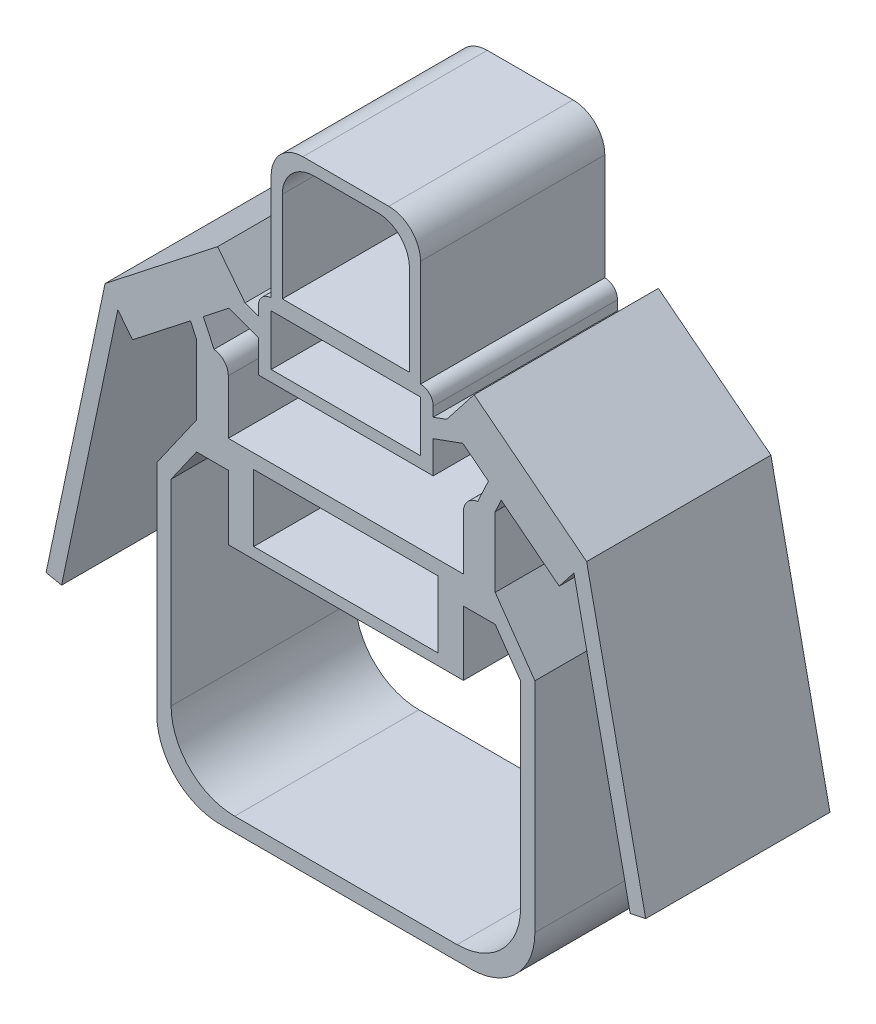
SolidWorks part; units mm, degrees
other "标注1"
sketch "草图17" plane through (-9.7594, -10.85, 5.8) normal (0, 0, 1) x (1, 0, 0)
ref_plane "前视基准面" through (0, 0, 0) normal (0, 0, 1) x (1, 0, 0)
ref_plane "上视基准面" through (0, 0, 0) normal (0, 1, 0) x (1, 0, 0)
ref_plane "右视基准面" through (0, 0, 0) normal (1, 0, 0) x (0, 0, -1)
other "Configuration Table"
sketch "草图1" plane through (0, 0, 0) normal (0, 0, 1) x (1, 0, 0)
  line L0 (2.75, 5.2) -> (3.1729, 5.3539)
  line L1 (-3.7, -1.4) -> (3.7, -1.4)
  line L2 (-3.7, -1.4) -> (-3.7, 1.4)
  line L4 (3.7, -1.4) -> (3.7, 0.1)
  line L5 (-3.7, -1.4) -> (3.7, 1.4) construction
  line L6 (-3.7, 1.4) -> (3.7, -1.4) construction
  line L7 (-2.75, 5.2) -> (2.75, 5.2)
  line L8 (-2.75, 5.2) -> (-2.75, 3.6)
  line L9 (-2.75, 3.6) -> (2.75, 3.6)
  line L10 (2.75, 4.6147) -> (2.75, 3.6)
  line L11 (-2.75, 5.2) -> (2.75, 3.6) construction
  line L12 (-2.75, 3.6) -> (2.75, 5.2) construction
  line L14 (3.7, 0.1) -> (4.7, 0.1)
  line L17 (4.0365, 6.4558) -> (3.1729, 5.3539)
  line L19 (4.0365, 6.4558) -> (7.5782, 3.6797)
  line L33 (2.75, 5.2) -> (2.75, 4.6147) construction
  line L34 (3.1729, 5.3539) -> (3.6828, 4.9542) construction
  line L37 (4.7, 3.6) -> (4.7, 0.1)
  line L38 (-3.7, 1.4) -> (3.7, 1.4)
  line L39 (3.7, 1.4) -> (3.7, 0.1) construction
  line L40 (0, 9.062) -> (0, -4.0269) construction
  line L41 (2.75, 4.6147) -> (3.6828, 4.9542)
  line L48 (3.6828, 4.9542) -> (4.4862, 4.3245)
  line L51 (4.1483, 3.6) -> (4.4862, 4.3245)
  line L53 (4.8902, 4.0078) -> (6.7145, 2.5779)
  line L55 (4.4862, 4.3245) -> (4.8902, 4.0078) construction
  line L56 (4.1483, 3.6) -> (4.7, 3.6) construction
  line L57 (3.7, 1.4) -> (3.7, 3.6)
  line L58 (3.7, 3.6) -> (4.1483, 3.6)
  line L59 (4.7, 3.6) -> (4.8902, 4.0078)
  line L60 (6.7145, 2.5779) -> (7.5782, 3.6797)
  point P0 (0, 0)
  point P6 (0, 4.4)
  dimension "D1" = 7.4
  dimension "D2" = 2.8
  dimension "D3" = 5.5
  dimension "D4" = 1.6
  dimension "D5" = 1
  dimension "D6" = 0.45
  dimension "D7" = 0.45
  dimension "D8" = 110
  dimension "D9" = 3.5
  dimension "D10" = 1.4
  dimension "D11" = 0.5
  dimension "D12" = 2.2
  dimension "D13" = 65
  dimension "D14" = 2.2
  dimension "D15" = 4.5
  dimension "D16" = 0.55
extrude "凸台-拉伸1" add sketch "草图1" along normal blind 5.8
mirror "镜向1" about plane through (0, 0, 0) normal (1, 0, 0) of "凸台-拉伸1"
sketch "草图10" plane through (0, 0, 5.8) normal (0, 0, 1) x (1, 0, 0)
  line L0 (-2.75, 3.6) -> (2.75, 3.6) construction
  line L1 (-2.9, -1.05) -> (2.9, -1.05)
  line L2 (-2.9, -1.05) -> (-2.9, 1.05)
  line L3 (-2.9, 1.05) -> (2.9, 1.05)
  line L4 (2.9, -1.05) -> (2.9, 1.05)
  line L5 (-2.9, -1.05) -> (2.9, 1.05) construction
  line L6 (-2.9, 1.05) -> (2.9, -1.05) construction
  line L7 (-2.35, 5.55) -> (2.35, 5.55)
  line L8 (-2.35, 5.55) -> (-2.35, 3.95)
  line L9 (-2.35, 3.95) -> (2.35, 3.95)
  line L10 (2.35, 5.55) -> (2.35, 3.95)
  point P0 (0, 0)
  point P10 (0, 5.55)
  dimension "D1" = 5.8
  dimension "D2" = 2.1
  dimension "D3" = 4.7
  dimension "D4" = 1.6
  dimension "D5" = 0.35
extrude "切除-拉伸3" cut sketch "草图10" against normal through all
sketch "草图11" plane through (0, 0, 5.8) normal (0, 0, 1) x (1, 0, 0)
  line L0 (-2.35, 5.2) -> (-2.75, 5.2)
  line L1 (-2.75, 5.2) -> (-2.75, 5.9)
  line L2 (-2.75, 5.9) -> (2.75, 5.9)
  line L3 (2.75, 5.9) -> (2.75, 5.2)
  line L4 (2.75, 3.6) -> (2.75, 4.6147) construction
  line L5 (2.75, 5.2) -> (2.35, 5.2)
  line L6 (2.35, 5.2) -> (2.35, 5.55)
  line L7 (2.35, 5.55) -> (-2.35, 5.55)
  line L8 (-2.35, 5.55) -> (-2.35, 5.2)
  line L9 (-2.35, 3.95) -> (2.35, 3.95) construction
  dimension "D1" = 0.35
  dimension "D2" = 1.6
extrude "凸台-拉伸2" add sketch "草图11" against normal up to surface (5.8 mm away)
fillet "圆角1" radius 0.4 2 edges at (-2.75, 5.9, 2.9) (2.75, 5.9, 2.9)
sketch "草图12" plane through (0, 0, 5.8) normal (0, 0, 1) x (1, 0, 0)
  line L0 (7.5782, 3.6797) -> (7.1772, 3.1681)
  line L1 (6.7145, 2.5779) -> (7.5782, 3.6797) construction
  line L2 (7.1772, 3.1681) -> (8.9484, -5.2293)
  line L3 (8.9484, -5.2293) -> (9.4356, -5.1265)
  line L4 (9.4356, -5.1265) -> (7.5782, 3.6797)
  line L5 (-7.5782, 3.6797) -> (-9.4356, -5.1265)
  line L6 (-9.4356, -5.1265) -> (-8.9484, -5.2293)
  line L7 (-8.9484, -5.2293) -> (-7.1772, 3.1681)
  line L8 (-6.7145, 2.5779) -> (-7.5782, 3.6797) construction
  line L9 (-7.1772, 3.1681) -> (-7.5782, 3.6797)
  dimension "D1" = 0.65
  dimension "D2" = 0.65
  dimension "D3" = 50
  dimension "D4" = 50
  dimension "D5" = 9
  dimension "D6" = 9
extrude "凸台-拉伸4" add sketch "草图12" against normal up to surface (5.8 mm away)
sketch "草图13" plane through (0, 0, 5.8) normal (0, 0, 1) x (1, 0, 0)
  line L0 (2.9, -1.05) -> (2.9, 1.05) construction
  line L1 (-2.9, 1.05) -> (2.9, 1.05)
  line L2 (-2.9, 1.05) -> (-2.9, 0.95)
  line L3 (-2.9, 0.95) -> (2.9, 0.95)
  line L4 (2.9, 1.05) -> (2.9, 0.95)
  line L5 (3.7, -1.4) -> (3.7, 0.1) construction
  line L6 (-3.7, -1.4) -> (3.7, -1.4)
  line L7 (-3.7, -1.4) -> (-3.7, -1.5)
  line L8 (-3.7, -1.5) -> (3.7, -1.5)
  line L9 (3.7, -1.4) -> (3.7, -1.5)
  dimension "D1" = 0.1
  dimension "D2" = 0.1
extrude "凸台-拉伸5" add sketch "草图13" against normal up to surface (5.8 mm away)
sketch "草图14" plane through (0, 0, 5.8) normal (0, 0, 1) x (1, 0, 0)
  line L0 (2.9, -1.05) -> (2.9, 0.95) construction
  line L1 (-2.9, -1.05) -> (2.9, -1.05)
  line L2 (-2.9, -1.05) -> (-2.9, -1.15)
  line L3 (-2.9, -1.15) -> (2.9, -1.15)
  line L4 (2.9, -1.05) -> (2.9, -1.15)
  dimension "D1" = 0.1
extrude "切除-拉伸4" cut sketch "草图14" against normal through all
sketch "草图15" plane through (0, 0, 5.8) normal (0, 0, 1) x (1, 0, 0)
  line L2 (2.35, 10.25) -> (-2.35, 10.25)
  line L3 (2.35, 5.9) -> (-2.35, 5.9) construction
  line L4 (-2.35, 5.9) -> (2.35, 5.9)
  line L34 (-5.95, -0.3852) -> (-5.95, -9.25)
  line L35 (-5.95, -9.25) -> (5.95, -9.25)
  line L36 (5.95, -9.25) -> (5.95, -0.3852)
  line L41 (5.5, -0.6142) -> (5.5, -8.8)
  line L42 (5.5, -8.8) -> (-5.5, -8.8)
  line L43 (-5.5, -8.8) -> (-5.5, -0.6142)
  line L45 (-2.35, 5.9) -> (-2.35, 10.25)
  line L46 (-3.7, -1.5) -> (3.7, -1.5) construction
  line L61 (-2, 6.05) -> (2, 6.05)
  line L67 (4.7, 1.4) -> (5.95, -0.3852)
  line L68 (4.7, 0.1) -> (4.7, 3.6) construction
  line L69 (5.5, -0.6142) -> (4.7, 0.5283)
  line L70 (-5.95, -0.3852) -> (-4.7, 1.4)
  line L71 (-4.7, 0.1) -> (-4.7, 3.6) construction
  line L72 (-5.5, -0.6142) -> (-4.7, 0.5283)
  line L73 (3.7, 1.4) -> (-3.7, 1.4) construction
  line L74 (-4.7, 1.4) -> (-4.7, 0.5283)
  line L75 (4.7, 1.4) -> (4.7, 0.5283)
  line L76 (4.7404, 9.8178) -> (1.1694, 7.1396) construction
  line L77 (4.7404, 9.8178) -> (4.7404, 9.5807) construction
  line L78 (2.35, 10.25) -> (4.7404, 9.5807) construction
  line L79 (4.8904, 10.1178) -> (0.9444, 7.1583) construction
  line L80 (4.8904, 10.1178) -> (4.8904, 9.3829) construction
  line L81 (2.3294, 10.1) -> (4.8904, 9.3829) construction
  line L82 (-4.85, 8) -> (-0.35, 8) construction
  line L83 (-2.3294, 10.1) -> (-4.7, 9.4362) construction
  line L84 (-4.7, 9.4362) -> (-4.7, 8.15) construction
  line L85 (-4.85, 9.55) -> (-4.85, 8) construction
  line L86 (-2.35, 10.25) -> (-4.85, 9.55) construction
  line L87 (-4.7, 8.15) -> (0, 8.15) construction
  line L88 (-2.35, 5.9) -> (-0.35, 8) construction
  line L89 (2.35, 5.9) -> (1.1694, 7.1396) construction
  line L90 (2.35, 5.9) -> (2.35, 10.25)
  line L91 (-2, 6.05) -> (-2, 9.9)
  line L92 (2.3294, 10.1) -> (-2.3294, 10.1) construction
  line L93 (-2, 6.05) -> (0, 8.15) construction
  line L94 (2, 6.05) -> (0.9444, 7.1583) construction
  line L95 (-2, 9.9) -> (2, 9.9)
  line L96 (2, 9.9) -> (2, 6.05)
  point P14 (0, 7.4)
  point P32 (0, -8.8)
  dimension "D2" = 0.5
  dimension "D4" = 11
  dimension "D5" = 7.3
  dimension "D6" = 0.45
  dimension "D7" = 0.45
  dimension "D8" = 0.45
  dimension "D3" = 4.35
  dimension "D9" = 0.15
  dimension "D10" = 0.35
  dimension "D11" = 0.35
  dimension "D12" = 0.35
  dimension "D13" = 0.5
  dimension "D14" = 35
  dimension "D15" = 35
extrude "凸台-拉伸6" add sketch "草图15" against normal up to surface (5.8 mm away)
sketch "草图21" plane through (0, 0, 5.8) normal (0, 0, 1) x (1, 0, 0)
  line L0 (-4.7, 0.5283) -> (-4.7, 0.1)
  line L1 (-4.7, 0.1) -> (-3.7, 0.1)
  line L2 (-3.7, 0.1) -> (-3.7, 0.5283)
  line L3 (-3.7, 0.5283) -> (-4.7, 0.5283)
  line L4 (3.7, 0.1) -> (4.7, 0.1)
  line L5 (4.7, 0.1) -> (4.7, 0.5283)
  line L6 (4.7, 0.5283) -> (3.7, 0.5283)
  line L7 (3.7, 0.5283) -> (3.7, 0.1)
extrude "切除-拉伸6" cut sketch "草图21" against normal through all
fillet "圆角2" radius 0.5 2 edges at (-3.7, 3.6, 2.9) (3.7, 3.6, 2.9)
sketch "草图22" plane through (0, 0, 5.8) normal (0, 0, 1) x (1, 0, 0)
  line L0 (-4.7, 1.4) -> (4.7, 1.4) construction
  line L1 (4.7, 1.4) -> (5.95, -0.3852) construction
  line L2 (5.95, -0.3852) -> (5.95, -9.25) construction
  line L3 (5.95, -9.25) -> (-5.95, -9.25) construction
  line L4 (-5.95, -9.25) -> (-5.95, -0.3852) construction
  line L5 (-5.95, -0.3852) -> (-4.7, 1.4) construction
  line L6 (-4.471, 0.96) -> (4.471, 0.96)
  line L7 (4.471, 0.96) -> (5.51, -0.5239)
  line L8 (5.51, -0.5239) -> (5.51, -8.81)
  line L9 (5.51, -8.81) -> (-5.51, -8.81)
  line L10 (-5.51, -8.81) -> (-5.51, -0.5239)
  line L11 (-5.51, -0.5239) -> (-4.471, 0.96)
  dimension "D1" = 0.44
extrude "凸台-拉伸15" [suppressed] add sketch "草图22" along normal blind 0.2
fillet "圆角3" radius 1 4 edges at (-2, 9.9, 2.9) (2, 9.9, 2.9) (2.35, 10.25, 2.9) (-2.35, 10.25, 2.9)
fillet "圆角4" radius 2 4 edges at (5.95, -9.25, 2.9) (-5.95, -9.25, 2.9) (5.5, -8.8, 2.9) (-5.5, -8.8, 2.9)
